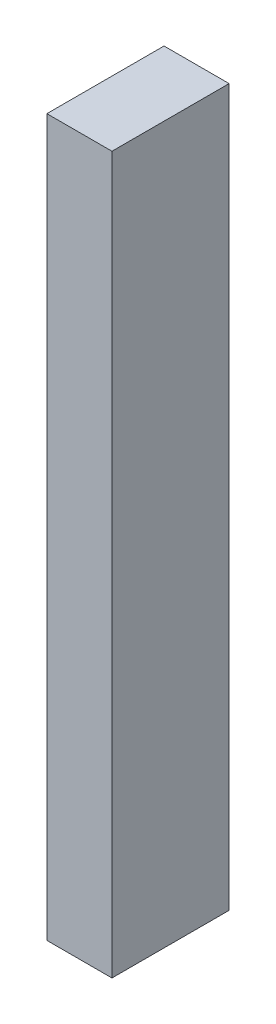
SolidWorks part; units mm, degrees
ref_plane "Plan de face" through (0, 0, 0) normal (0, 0, 1) x (1, 0, 0)
ref_plane "Plan de dessus" through (0, 0, 0) normal (0, 1, 0) x (1, 0, 0)
ref_plane "Plan de droite" through (0, 0, 0) normal (1, 0, 0) x (0, 0, -1)
sketch "Esquisse1" plane through (0, 0, 0) normal (0, 0, 1) x (1, 0, 0)
  line L1 (0, 0) -> (10, 0)
  line L2 (0, 0) -> (0, 110)
  line L3 (0, 110) -> (10, 110)
  line L4 (10, 0) -> (10, 110)
  dimension "D1" = 10
  dimension "D2" = 110
extrude "Extrusion1" add sketch "Esquisse1" against normal blind 18
